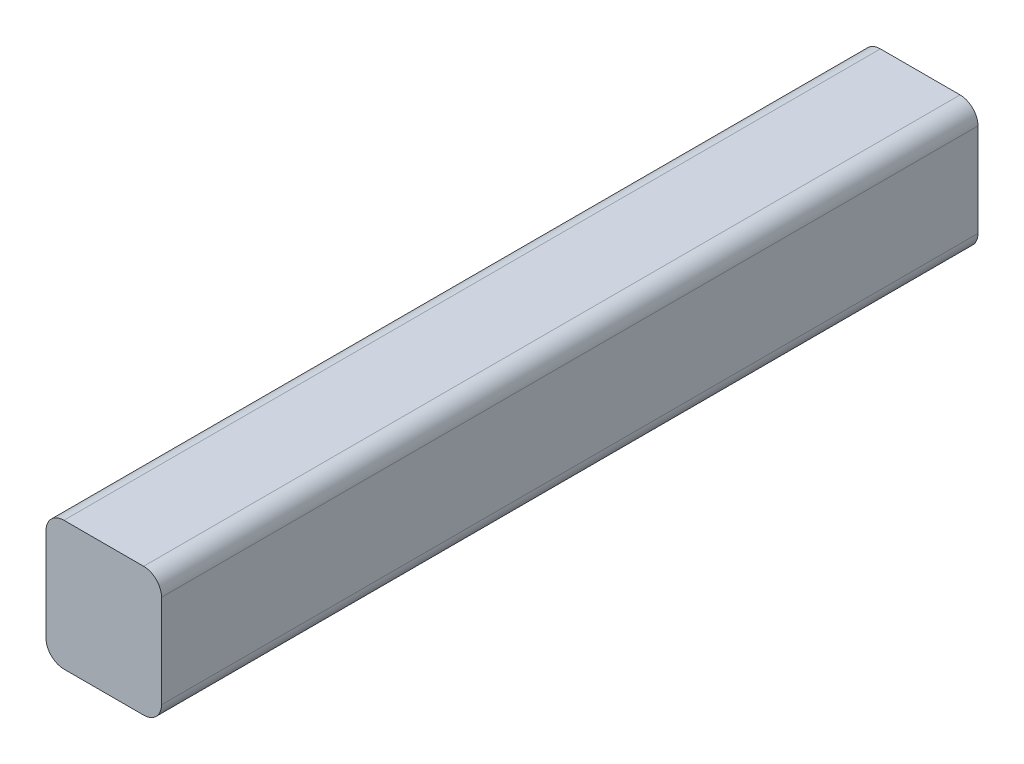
SolidWorks part; units mm, degrees
ref_plane "Front Plane" through (0, 0, 0) normal (0, 0, 1) x (1, 0, 0)
ref_plane "Top Plane" through (0, 0, 0) normal (0, 1, 0) x (1, 0, 0)
ref_plane "Right Plane" through (0, 0, 0) normal (1, 0, 0) x (0, 0, -1)
sketch "Sketch1" plane through (0, 0, 0) normal (0, 0, 1) x (1, 0, 0)
  line L1 (22.78, 22.78) -> (22.78, -13.22)
  line L2 (22.78, -13.22) -> (-9.48, -13.22)
  line L3 (-9.48, -13.22) -> (-9.48, 22.78)
  line L5 (-9.48, 22.78) -> (22.78, 22.78)
  dimension "D1" = 36
  dimension "D2" = 32.26
extrude "Boss-Extrude1" add sketch "Sketch1" along normal blind 228
fillet "Fillet1" radius 5 4 edges at (-9.48, -13.22, 114) (-9.48, 22.78, 114) (22.78, 22.78, 114) (22.78, -13.22, 114)
